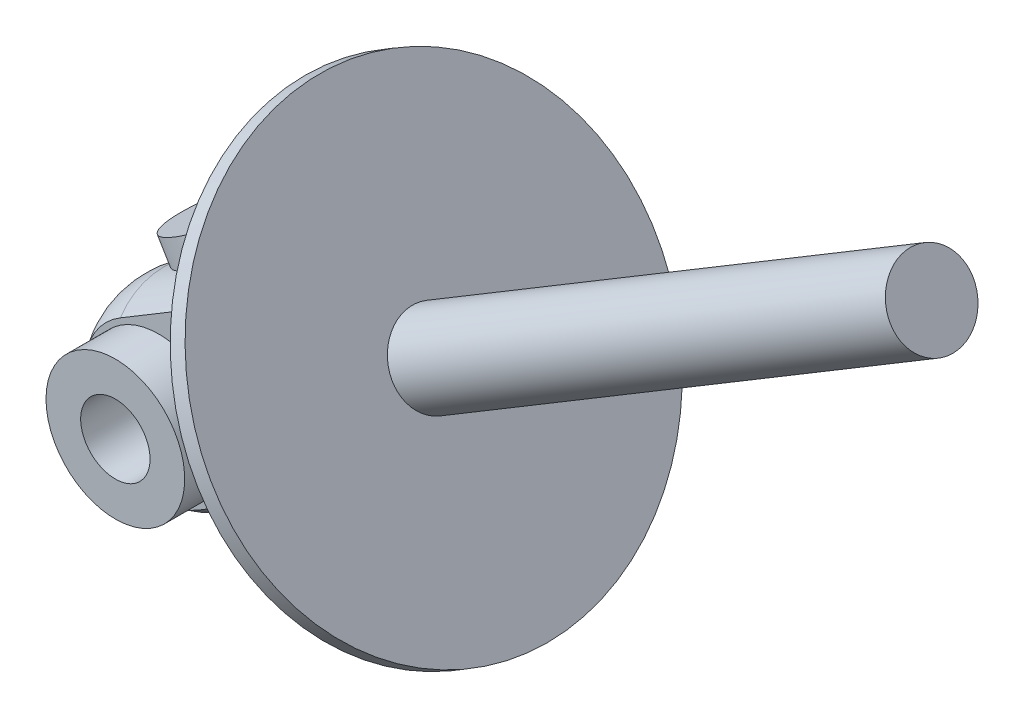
SolidWorks part; units mm, degrees
ref_plane "Face" through (0, 0, 0) normal (0, 0, 1) x (1, 0, 0)
ref_plane "Dessus" through (0, 0, 0) normal (0, 1, 0) x (1, 0, 0)
ref_plane "Droite" through (0, 0, 0) normal (1, 0, 0) x (0, 0, -1)
imported_body "Importée1"
sketch "Esquisse3" plane through (96.0474, 57.6728, 0) normal (0.8573, 0.5148, 0) x (0, 0, -1)
  circle A3 centre (0, 219.0913) radius 35.5
  circle A4 centre (0, 219.0913) radius 35.5
  dimension "D1" = 10
extrude "Enlèv. mat.-Extru.2" cut sketch "Esquisse3" along normal through all
sketch "Esquisse4" plane through (96.0474, 57.6728, 0) normal (0.8573, 0.5148, 0) x (0, 0, -1)
  circle A0 centre (0, 219.0913) radius 4.75
  circle A1 centre (0, 219.0913) radius 25.5 construction
  dimension "D1" = 9.5
extrude "Extrusion1" add sketch "Esquisse4" along normal blind 67
sketch "ancrage ressort" plane through (96.0474, 57.6728, 0) normal (0.8573, 0.5148, 0) x (0, 0, -1)
  point P0 (0, 219.0913)
